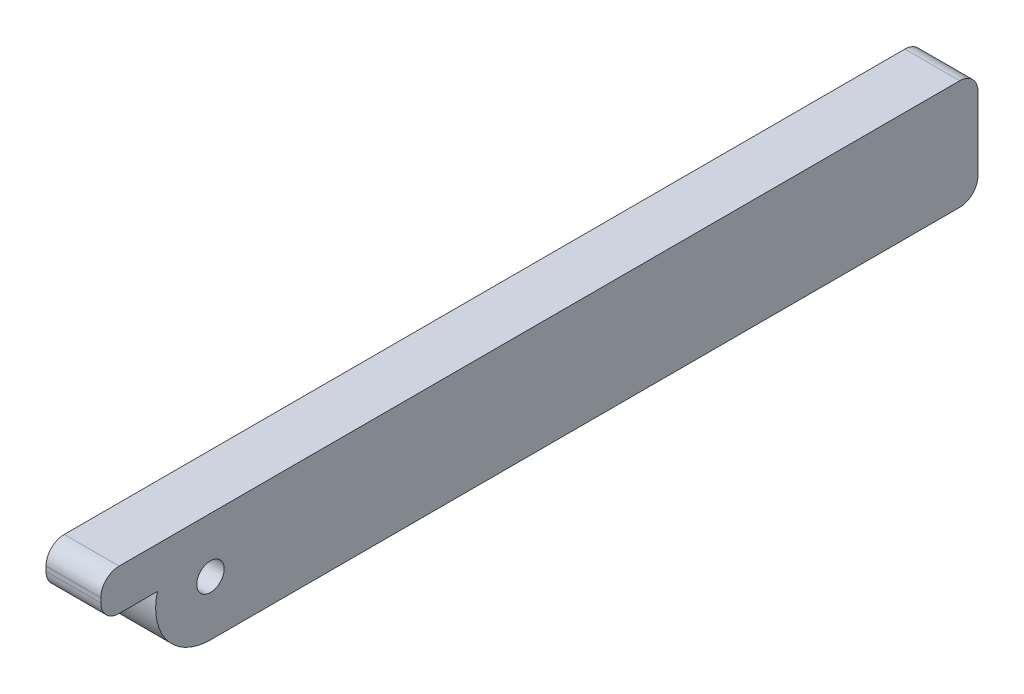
SolidWorks part; units mm, degrees
ref_plane "Front Plane" through (0, 0, 0) normal (0, 0, 1) x (1, 0, 0)
ref_plane "Top Plane" through (0, 0, 0) normal (0, 1, 0) x (1, 0, 0)
ref_plane "Right Plane" through (0, 0, 0) normal (1, 0, 0) x (0, 0, -1)
body saved out of another part "Stock-V1-1"
move or copy body "Body-Move/Copy1" bodies to move or copy 101 copy no rotation origin (149, 0, -229.8362) rotation axis (0, 1, 0) rotation angle 180
move or copy body "Body-Move/Copy2" bodies to move or copy 102 copy no rotation origin (0, 63.6771, -229.8362) rotation axis (-1, 0, 0) rotation angle 52
